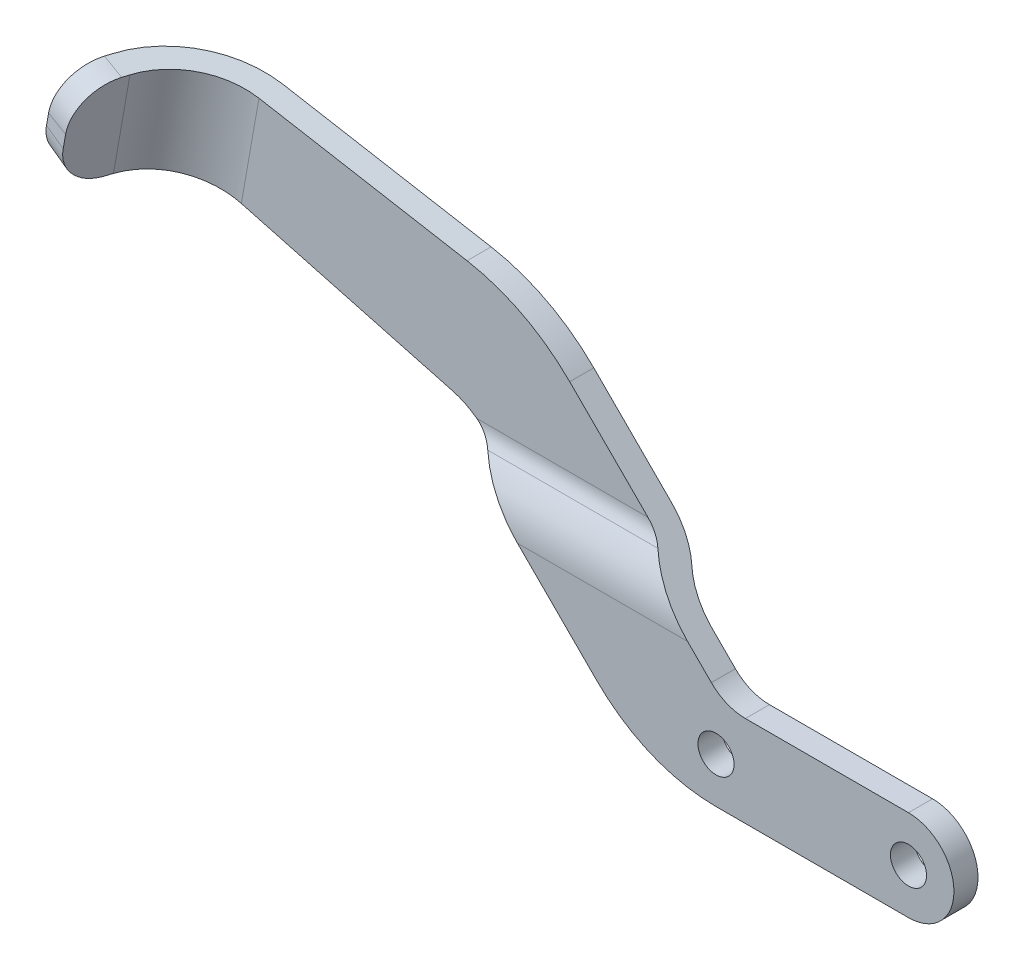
SolidWorks part; units mm, degrees
ref_plane "front" through (0, 0, 0) normal (0, 0, 1) x (1, 0, 0)
ref_plane "top" through (0, 0, 0) normal (0, 1, 0) x (1, 0, 0)
ref_plane "side" through (0, 0, 0) normal (1, 0, 0) x (0, 0, -1)
sketch "Sketch1" plane through (0, 0, 0) normal (0, 0, 1) x (1, 0, 0)
  line L0 (0, 6) -> (-21.525, 6)
  line L1 (0, -6) -> (-25.4, -6)
  line L2 (-26.0151, 7.8599) -> (-47.8835, 29.7283)
  line L3 (-59.1089, 18.503) -> (-41.1154, 0.5096)
  line L4 (-63.3788, 20.9682) -> (-91.2266, 28.43)
  line L5 (-61.4334, 36.7819) -> (-88.9, 41.625)
  line L6 (-91.2266, 28.43) -> (-88.9, 41.625)
  arc A0 (0, 6) -> (0, -6) centre (0, 0) cw
  arc A1 (-25.4, -6) -> (-41.1154, 0.5096) centre (-25.4, 16.225) cw
  arc A2 (-26.0151, 7.8599) -> (-21.525, 6) centre (-21.525, 12.35) ccw
  arc A3 (-59.1089, 18.503) -> (-63.3788, 20.9682) centre (-65.8441, 11.7678) ccw
  arc A4 (-47.8835, 29.7283) -> (-61.4334, 36.7819) centre (-65.8441, 11.7678) ccw
  dimension "D6" = 22.225
  dimension "D7" = 6.35
  dimension "D10" = 25.4
  dimension "D8" = 25.4
  dimension "D1" = 15
  dimension "D2" = 12
  dimension "D3" = 15.875
  dimension "D4" = 5
  dimension "D5" = 135
  dimension "D9" = 88.9
  dimension "D11" = 47.625
extrude "Base-Extrude" add sketch "Sketch1" along normal mid plane 6.35
sketch "Sketch2" plane through (0, 0, 0) normal (1, 0, 0) x (0, 0, -1)
  line L0 (3.175, -6) -> (3.175, 30.3525) construction
  line L1 (0, -6) -> (0, 10.9997)
  line L2 (-3.175, -6) -> (3.175, -6) construction
  line L3 (3.175, 29.7283) -> (3.175, 36.7819) construction
  line L4 (0, -6) -> (3.175, -6)
  arc A0 (0, 10.9997) -> (1.5875, 15.1999) centre (6.35, 10.9997) cw
  arc A2 (1.5875, 15.1999) -> (3.175, 19.4) centre (-3.175, 19.4) ccw
  dimension "D1" = 6.35
  dimension "D2" = 6.35
  dimension "D3" = 25.4
  dimension "D4" = 3.175
extrude "Cut-Extrude1" cut sketch "Sketch2" against normal through all and the other way through all flip side to cut
sketch "Sketch3" plane through (0, 0, 0) normal (1, 0, 0) x (0, 0, -1)
  line L0 (-3.175, 7.8599) -> (-3.175, 29.7283) construction
  line L1 (0, 19.4) -> (0, 41.625)
  line L2 (-3.175, 41.625) -> (3.175, 41.625) construction
  line L3 (0, 41.625) -> (-3.175, 41.625)
  line L4 (-3.175, 41.625) -> (-3.175, 10.9997)
  line L7 (3.175, 19.4) -> (3.175, 42.0866) construction
  arc A0 (1.5875, 15.1999) -> (3.175, 19.4) centre (-3.175, 19.4) ccw construction
  arc A1 (0, 19.4) -> (-0.7938, 17.2999) centre (-3.175, 19.4) cw
  arc A2 (-0.7938, 17.2999) -> (-3.175, 10.9997) centre (6.35, 10.9997) ccw
  arc A3 (1.5875, 15.1999) -> (0, 10.9997) centre (6.35, 10.9997) ccw construction
extrude "Cut-Extrude2" cut sketch "Sketch3" against normal through all
sketch "Sketch4" plane through (0, 0, 3.175) normal (0, 0, 1) x (1, 0, 0)
  line L0 (0, 0) -> (-25.4, 0) construction
  circle A0 centre (0, 0) radius 2.3813
  circle A1 centre (-25.4, 0) radius 2.3813
  dimension "D1" = 4.7625
  dimension "D2" = 25.4
extrude "Cut-Extrude3" cut sketch "Sketch4" against normal through all
sketch "Sketch6" plane through (4.4376, 25.1671, 0) normal (0.1736, 0.9848, 0) x (-0.9848, 0.1736, 0)
  line L1 (94.7775, -3.175) -> (94.7775, 0)
  line L2 (107.5081, 6.7355) -> (109.0409, 12.793)
  line L3 (109.0409, 12.793) -> (105.9629, 13.5718)
  line L4 (105.9629, 13.5718) -> (104.4301, 7.5143)
  line L5 (66.8872, -3.175) -> (94.7775, -3.175) construction
  line L7 (94.7775, 0) -> (94.7775, -3.175) construction
  line L8 (94.7775, 0) -> (66.8872, 0) construction
  arc A0 (94.7775, -3.175) -> (107.5081, 6.7355) centre (94.7775, 9.9568) ccw
  arc A1 (94.7775, 0) -> (104.4301, 7.5143) centre (94.7775, 9.9568) ccw
  dimension "D1" = 13.1318
  dimension "D3" = 6.2484
  dimension "D4" = 104.2
extrude "Boss-Extrude1" add sketch "Sketch6" against normal up to surface (13.3985 mm away)
fillet "Fillet4" radius 5.334 2 edges at (-103.5644, 31.7359, 13.1824) (-101.431, 43.8346, 13.1824)
